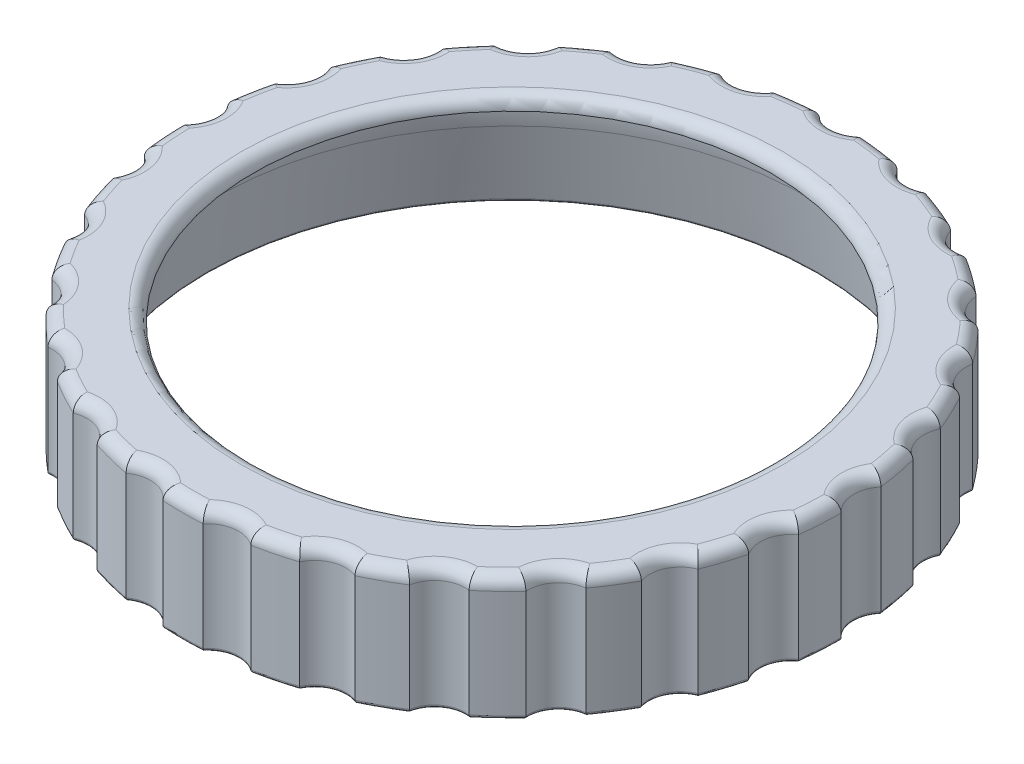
SolidWorks part; units mm, degrees
ref_plane "Front" through (0, 0, 0) normal (0, 0, 1) x (1, 0, 0)
ref_plane "Top" through (0, 0, 0) normal (0, 1, 0) x (1, 0, 0)
ref_plane "Right" through (0, 0, 0) normal (1, 0, 0) x (0, 0, -1)
sketch "Sketch1" plane through (0, 0, 0) normal (1, 0, 0) x (0, 0, -1)
  line L0 (0, 1.4549) -> (0, -1.4549) construction
  line L1 (-21, 0.1625) -> (-21, 1.1625)
  line L2 (-23.5, -0.1625) -> (23.5, -0.1625) construction
  line L3 (-23.5, -0.1625) -> (-23.5, 0.1625) construction
  line L4 (-23.5, 0.1625) -> (23.5, 0.1625) construction
  line L5 (23.5, -0.1625) -> (23.5, 0.1625) construction
  line L6 (-23.5, -0.1625) -> (23.5, 0.1625) construction
  line L7 (-23.5, 0.1625) -> (23.5, -0.1625) construction
  line L8 (-21, 1.1625) -> (-26.75, 1.1625)
  line L9 (-26.75, 1.1625) -> (-26.75, -8.8375)
  line L10 (-21, 0.1625) -> (-23.5, 0.1625)
  line L11 (-23.5, 0.1625) -> (-23.75, 0.1625)
  line L12 (-23.75, 0.1625) -> (-23.75, -2.1625)
  line L13 (-23.5, -0.1625) -> (-23.75, -0.1625) construction
  line L14 (-23.75, -2.1625) -> (-24.75, -8.8375)
  line L15 (-24.75, -8.8375) -> (-26.75, -8.8375)
  point P1 (0, 0)
  point P4 (0, 0)
revolve "Revolve1" add sketch "Sketch1" angle 360 about L0
sketch "Sketch2" plane through (0, 1.1625, 0) normal (0, 1, 0) x (1, 0, 0)
  line L0 (0, 24.75) -> (0, 26) construction
  circle A0 centre (0, 0) radius 24.75 construction
  circle A1 centre (0, 0) radius 24.75 construction
  circle A2 centre (0, 0) radius 23.75 construction
  circle A3 centre (0, 0) radius 23.75 construction
  circle A4 centre (0, 28.5) radius 2.5
  dimension "D1" = 5
  dimension "D2" = 1.25
extrude "Cut-Extrude1" cut sketch "Sketch2" against normal through all
pattern_circular "CirPattern1" count 25 over 360 about axis through (0, 0, 0) along (0, 1, 0) of "Cut-Extrude1"
fillet "Fillet4" radius 1 51 edges at (0, 1.1625, 21) (18.3116, 1.1625, 19.4999) (22.5858, 1.1625, 14.3334) (20.0333, 1.1625, 16.573) (12.8869, 1.1625, 23.4412) (15.2824, 1.1625, 21.0344) (6.6525, 1.1625, 25.9096) (9.5712, 1.1625, 24.1742) (0, 1.1625, 26.75) (3.2587, 1.1625, 25.795) (-6.6525, 1.1625, 25.9096) (-3.2587, 1.1625, 25.795) (-12.8869, 1.1625, 23.4412) (-9.5712, 1.1625, 24.1742) (-18.3116, 1.1625, 19.4999) (-15.2824, 1.1625, 21.0344) (-22.5858, 1.1625, 14.3334) (-20.0333, 1.1625, 16.573) (-25.4408, 1.1625, 8.2662) (-23.5255, 1.1625, 11.0703) (-26.6972, 1.1625, 1.6796) (-25.5395, 1.1625, 4.8719) (-26.2762, 1.1625, -5.0125) (-25.9487, 1.1625, -1.6326) (-24.2041, 1.1625, -11.3896) (-24.7275, 1.1625, -8.0344) (-20.6112, 1.1625, -17.0511) (-21.9525, 1.1625, -13.9315) (-15.7233, 1.1625, -21.6412) (-17.7982, 1.1625, -18.9532) (-9.8473, 1.1625, -24.8715) (-12.5256, 1.1625, -22.784) (-3.3527, 1.1625, -26.5391) (-6.4659, 1.1625, -25.1832) (0, 1.1625, -26) (9.8473, 1.1625, -24.8715) (3.3527, 1.1625, -26.5391) (6.4659, 1.1625, -25.1832) (15.7233, 1.1625, -21.6412) (12.5256, 1.1625, -22.784) (20.6112, 1.1625, -17.0511) (17.7982, 1.1625, -18.9532) (24.2041, 1.1625, -11.3896) (21.9525, 1.1625, -13.9315) (26.2762, 1.1625, -5.0125) (24.7275, 1.1625, -8.0344) (26.6972, 1.1625, 1.6796) (25.9487, 1.1625, -1.6326) (25.4408, 1.1625, 8.2662) (25.5395, 1.1625, 4.8719) (23.5255, 1.1625, 11.0703)
fillet "Fillet5" radius 0.25 51 edges at (0, -8.8375, 24.75) (22.5858, -8.8375, 14.3334) (25.4408, -8.8375, 8.2662) (25.5395, -8.8375, 4.8719) (26.6972, -8.8375, 1.6796) (25.9487, -8.8375, -1.6326) (26.2762, -8.8375, -5.0125) (24.7275, -8.8375, -8.0344) (24.2041, -8.8375, -11.3896) (21.9525, -8.8375, -13.9315) (20.6112, -8.8375, -17.0511) (17.7982, -8.8375, -18.9532) (15.7233, -8.8375, -21.6412) (12.5256, -8.8375, -22.784) (9.8473, -8.8375, -24.8715) (6.4659, -8.8375, -25.1832) (3.3527, -8.8375, -26.5391) (0, -8.8375, -26) (-3.3527, -8.8375, -26.5391) (-6.4659, -8.8375, -25.1832) (-9.8473, -8.8375, -24.8715) (-12.5256, -8.8375, -22.784) (-15.7233, -8.8375, -21.6412) (-17.7982, -8.8375, -18.9532) (-20.6112, -8.8375, -17.0511) (-21.9525, -8.8375, -13.9315) (-24.2041, -8.8375, -11.3896) (-24.7275, -8.8375, -8.0344) (-26.2762, -8.8375, -5.0125) (-25.9487, -8.8375, -1.6326) (-26.6972, -8.8375, 1.6796) (-25.5395, -8.8375, 4.8719) (-25.4408, -8.8375, 8.2662) (-23.5255, -8.8375, 11.0703) (-22.5858, -8.8375, 14.3334) (-20.0333, -8.8375, 16.573) (-18.3116, -8.8375, 19.4999) (-15.2824, -8.8375, 21.0344) (-12.8869, -8.8375, 23.4412) (-9.5712, -8.8375, 24.1742) (-6.6525, -8.8375, 25.9096) (-3.2587, -8.8375, 25.795) (0, -8.8375, 26.75) (3.2587, -8.8375, 25.795) (6.6525, -8.8375, 25.9096) (9.5712, -8.8375, 24.1742) (12.8869, -8.8375, 23.4412) (15.2824, -8.8375, 21.0344) (18.3116, -8.8375, 19.4999) (20.0333, -8.8375, 16.573) (23.5255, -8.8375, 11.0703)
fillet "Fillet6" radius 10 1 edges at (0, -2.1625, 23.75)
equation "\"filter_dia_tolerance\"= .25"
equation "\"filter_dia\"= 47"
equation "\"D2@Sketch1\"=\"filter_dia\""
equation "\"D5@Sketch1\"=\"filter_dia_tolerance\""
